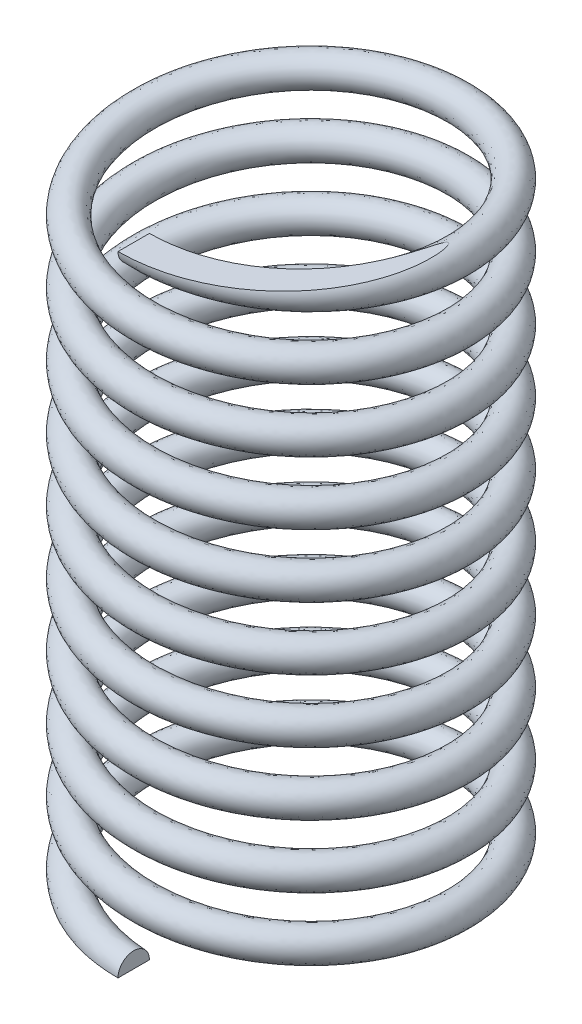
SolidWorks part; units mm, degrees
ref_plane "Front Plane" through (0, 0, 0) normal (0, 0, 1) x (1, 0, 0)
ref_plane "Top Plane" through (0, 0, 0) normal (0, 1, 0) x (1, 0, 0)
ref_plane "Right Plane" through (0, 0, 0) normal (1, 0, 0) x (0, 0, -1)
sketch "Sketch1" plane through (0, 0, 0) normal (0, 1, 0) x (1, 0, 0)
  circle A0 centre (0, 0) radius 25
  dimension "D1" = 50
curve "Helix/Spiral1"
sketch "Sketch2" plane through (0, 0, 0) normal (1, 0, 0) x (0, 0, -1)
  circle A0 centre (-25, 0) radius 2.5
  point P2 (0, 0)
  point P4 (0, 0)
  point P5 (-25, 0)
  point P6 (-25, 0)
  point P7 (0, 0)
  dimension "D1" = 5
sweep "Sweep1" add profiles "Sketch2" path "Helix/Spiral1"
ref_plane "Plane1" through (0, 100, 0) normal (0, 1, 0) x (1, 0, 0)
other "SurfaceCut1"
other "SurfaceCut2"
